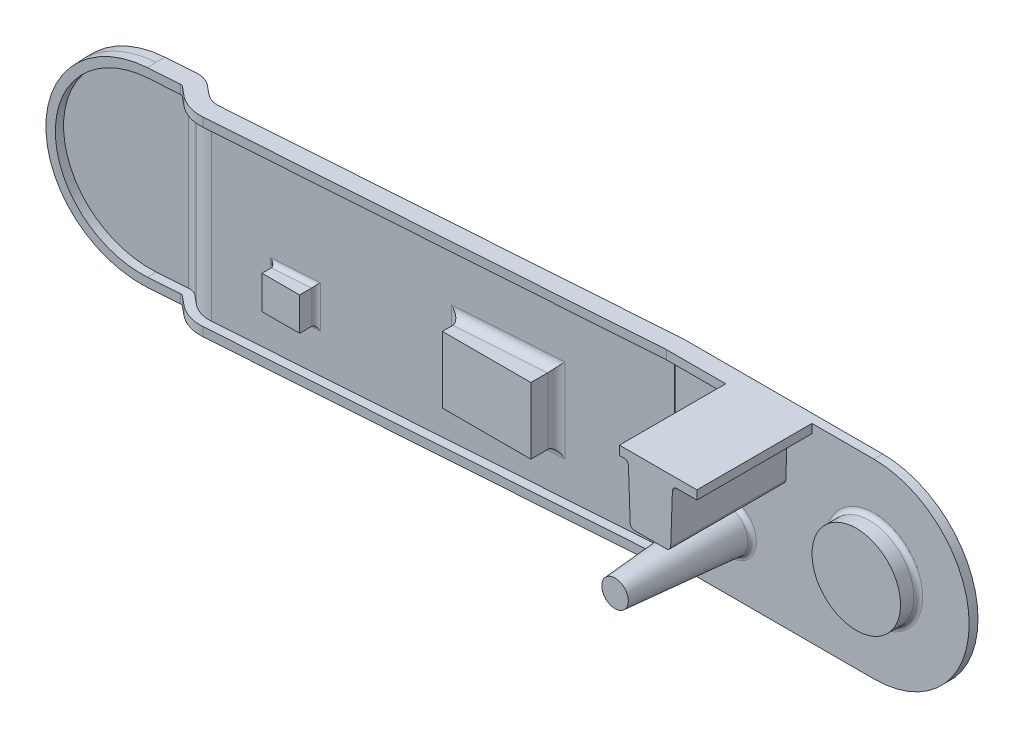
SolidWorks part; units mm, degrees
ref_plane "Plan de face" through (0, 0, 0) normal (0, 0, 1) x (1, 0, 0)
ref_plane "Plan de dessus" through (0, 0, 0) normal (0, 1, 0) x (1, 0, 0)
ref_plane "Plan de droite" through (0, 0, 0) normal (1, 0, 0) x (0, 0, -1)
inserted part "avt bras droit01<1>@Assemblage1"
ref_plane "Plan1" through (0, 0, 56) normal (0, 0, 1) x (1, 0, 0)
